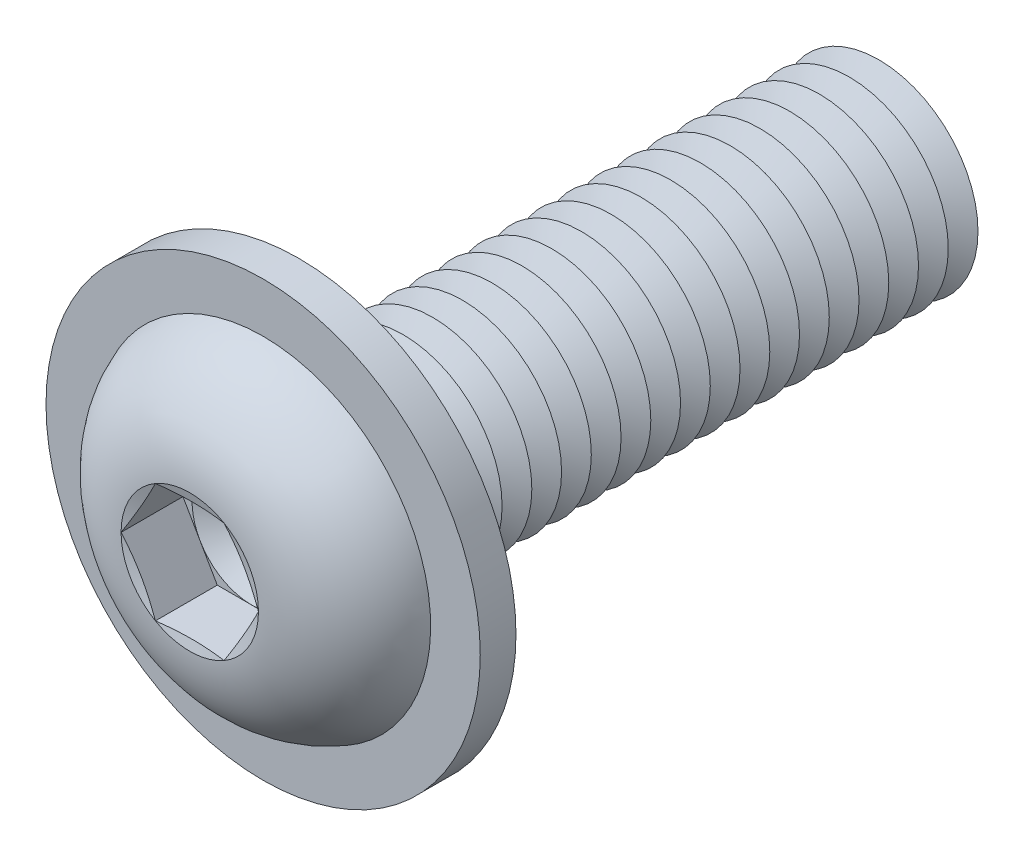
SolidWorks part; units mm, degrees
ref_plane "Front Plane" through (0, 0, 0) normal (0, 0, 1) x (1, 0, 0)
ref_plane "Top Plane" through (0, 0, 0) normal (0, 1, 0) x (1, 0, 0)
ref_plane "Right Plane" through (0, 0, 0) normal (1, 0, 0) x (0, 0, -1)
sketch "Sketch1" plane through (0, 0, 0) normal (1, 0, 0) x (0, 0, -1)
  line L0 (0, 5) -> (0, 8.75)
  line L3 (0, 5) -> (30, 5)
  line L4 (30, 5) -> (30, 0)
  line L5 (30, 0) -> (-5.5, 0) construction
  line L6 (-5.5, 0) -> (30, 0)
  line L7 (-5.5, 3.4641) -> (-5.5, 1.732) construction
  line L8 (-5.5, 1.732) -> (-5.5, 0)
  line L9 (-5.5, 3.4641) -> (-5.0359, 1.732)
  line L10 (-5.0359, 1.732) -> (-5.5, 1.732)
  line L11 (30, 0) -> (22.7481, 0) construction
  line L12 (0, 8.75) -> (-5.5, 8.75) construction
  arc A1 (0, 8.75) -> (-5.5, 3.4641) centre (0, 3.2457) ccw
  point P8 (30, 2.5)
  dimension "D1" = 17.5
  dimension "D2" = 10
  dimension "D3" = 5.5
  dimension "D4" = 6.9282
  dimension "D5" = 30
  dimension "D6" = 15
revolve "Revolve1" add sketch "Sketch1" angle 360 about L5
fillet "Fillet1" radius 0.75 1 edges at (0, 5, 0)
sketch "Sketch2" plane through (0, 0, 0) normal (1, 0, 0) x (0, 0, -1)
  line L0 (29.25, 5) -> (30.75, 5)
  line L1 (30, 5) -> (0.75, 5) construction
  line L2 (30.75, 5) -> (30, 3.701)
  line L3 (30, -5) -> (30, 5) construction
  line L4 (30, 3.701) -> (29.25, 5)
  dimension "D1" = 1.5
revolve "Cut-Revolve1" cut sketch "Sketch2" angle 360 about axis through (0, 0, -30) along (0, 0, -1)
pattern_linear "LPattern1" count 20 spacing 1.5 along (0, 0, 1) of "Cut-Revolve1"
sketch "Sketch3" plane through (0, 0, 5.5) normal (0, 0, 1) x (1, 0, 0)
  line L7 (1.732, 3) -> (-1.7321, 3)
  line L8 (-1.7321, 3) -> (-3.4641, 0)
  line L9 (-3.4641, 0) -> (-1.732, -3)
  line L10 (-1.732, -3) -> (1.732, -3)
  line L11 (1.732, -3) -> (3.4641, 0)
  line L12 (3.4641, 0) -> (1.732, 3)
  circle A0 centre (0, 0) radius 3 construction
  circle A3 centre (0, 0) radius 3.4641 construction
extrude "Cut-Extrude1" cut sketch "Sketch3" against normal blind 3.12
sketch "Sketch4" plane through (0, 0, 2.38) normal (0, 0, 1) x (1, 0, 0)
  line L1 (1.732, 3) -> (-1.7321, 3) construction
  circle A0 centre (0, 0) radius 3
extrude "Cut-Extrude2" cut sketch "Sketch4" against normal through all draft 60
sketch "Sketch5" plane through (0, 0, 0) normal (0, 0, -1) x (-1, 0, 0)
  circle A0 centre (0, 0) radius 10.95
  circle A1 centre (0, 0) radius 5.75
  circle A2 centre (0, 0) radius 5.75 construction
  dimension "D1" = 21.9
extrude "Boss-Extrude1" add sketch "Sketch5" against normal blind 1.8
